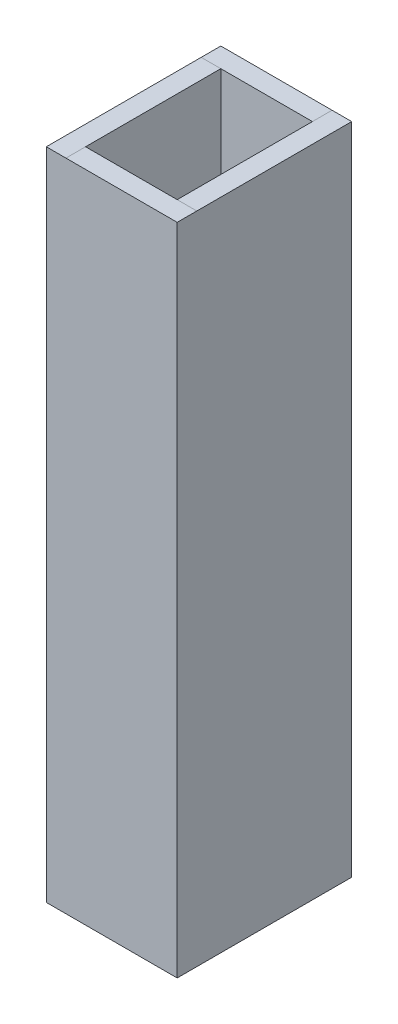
SolidWorks part; units mm, degrees
ref_plane "Front Plane" through (0, 0, 0) normal (0, 0, 1) x (1, 0, 0)
ref_plane "Top Plane" through (0, 0, 0) normal (0, 1, 0) x (1, 0, 0)
ref_plane "Right Plane" through (0, 0, 0) normal (1, 0, 0) x (0, 0, -1)
sketch "Sketch2" plane through (0, 0, 0) normal (0, 1, 0) x (1, 0, 0)
  line L1 (0, 0) -> (-76.2, 0)
  line L2 (0, 0) -> (0, 101.6)
  line L3 (0, 101.6) -> (-76.2, 101.6)
  line L4 (-76.2, 0) -> (-76.2, 101.6)
  dimension "D1" = 76.2
  dimension "D2" = 101.6
extrude "Extrude1" add sketch "Sketch2" along normal blind 381
sketch "Sketch8" plane through (0, 381, 0) normal (0, 1, 0) x (-1, 0, 0)
  line L8 (11.43, -11.43) -> (11.43, -90.17)
  line L9 (11.43, -90.17) -> (64.77, -90.17)
  line L10 (64.77, -90.17) -> (64.77, -11.43)
  line L11 (64.77, -11.43) -> (11.43, -11.43)
  line L12 (11.43, -11.43) -> (11.43, -90.17)
  line L13 (11.43, -90.17) -> (64.77, -90.17)
  line L14 (64.77, -90.17) -> (64.77, -11.43)
  line L15 (64.77, -11.43) -> (11.43, -11.43)
  dimension "D1" = 11.43
extrude "Cut-Extrude2" cut sketch "Sketch8" against normal blind 134.62
sketch "Sketch10" plane through (0, 381, 0) normal (0, 1, 0) x (-1, 0, 0)
  line L1 (76.2, -101.6) -> (11.43, -101.6)
  line L2 (76.2, -101.6) -> (76.2, -90.17)
  line L3 (76.2, -90.17) -> (11.43, -90.17)
  line L4 (11.43, -101.6) -> (11.43, -90.17)
sketch "Sketch11" plane through (0, 381, 0) normal (0, 1, 0) x (-1, 0, 0)
  line L1 (76.2, 0) -> (0, 0) construction
  line L2 (64.77, -90.17) -> (76.2, -90.17)
  line L3 (64.77, -90.17) -> (64.77, 0)
  line L4 (64.77, 0) -> (76.2, 0)
  line L5 (76.2, -90.17) -> (76.2, 0)
  line L6 (76.2, -101.6) -> (76.2, 0) construction
sketch "Sketch13" plane through (0, 381, 0) normal (0, 1, 0) x (-1, 0, 0)
  line L1 (64.77, -11.43) -> (0, -11.43)
  line L2 (64.77, -11.43) -> (64.77, 0)
  line L3 (64.77, 0) -> (0, 0)
  line L4 (0, -11.43) -> (0, 0)
sketch "Sketch14" plane through (0, 381, 0) normal (0, 1, 0) x (-1, 0, 0)
  line L1 (0, -101.6) -> (11.43, -101.6)
  line L2 (0, -101.6) -> (0, -11.43)
  line L3 (0, -11.43) -> (11.43, -11.43)
  line L4 (11.43, -101.6) -> (11.43, -11.43)
